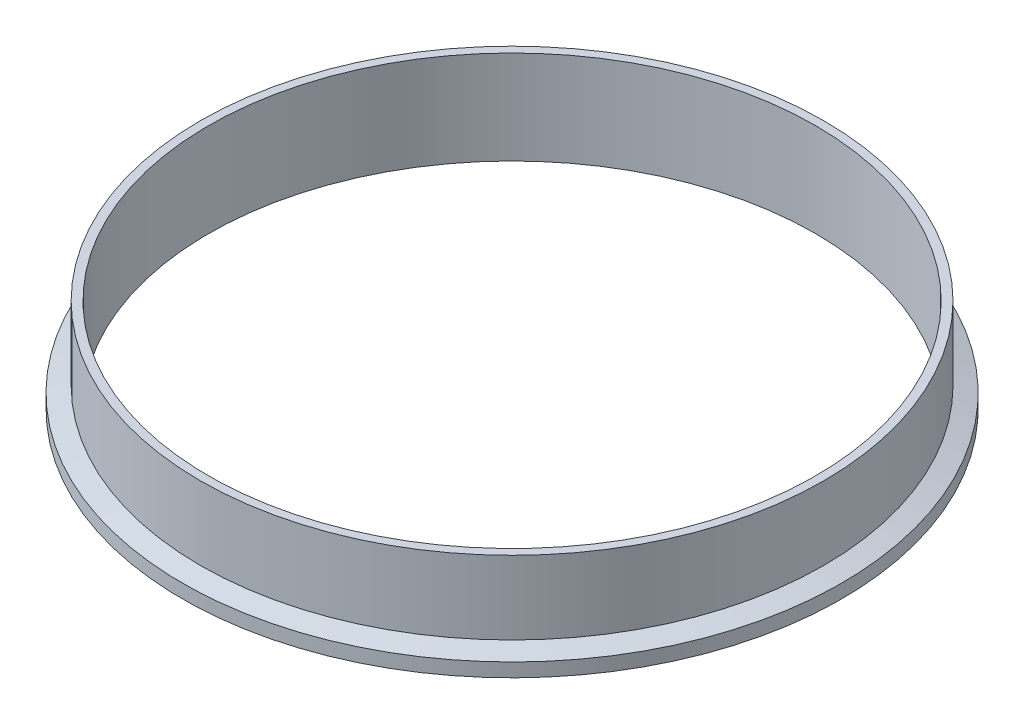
SolidWorks part; units mm, degrees
ref_plane "Front Plane" through (0, 0, 0) normal (0, 0, 1) x (1, 0, 0)
ref_plane "Top Plane" through (0, 0, 0) normal (0, 1, 0) x (1, 0, 0)
ref_plane "Right Plane" through (0, 0, 0) normal (1, 0, 0) x (0, 0, -1)
sketch "Sketch1" plane through (0, 0, 0) normal (0, 0, 1) x (1, 0, 0)
  line L0 (0, 0) -> (0, 38.1) construction
  line L1 (0, 38.1) -> (-127, 38.1)
  line L2 (-127, 38.1) -> (-127, 8.2228)
  line L3 (-127, 8.2228) -> (-134.239, 5.588)
  line L4 (-134.239, 5.588) -> (-134.239, 0)
  line L5 (-134.239, 0) -> (-130.7992, 0)
  line L6 (-127.1632, 0) -> (0, 0)
  line L7 (0, 0) -> (0, 38.1)
  line L8 (0, 38.1) -> (-123.5964, 38.1)
  line L9 (-123.5964, 38.1) -> (-123.5964, 0)
  line L10 (-123.5964, 0) -> (0, 0)
  line L11 (0, 0) -> (-0.1846, 0.0129)
  arc A0 (-130.0767, 0.4745) -> (-127.8857, 0.4745) centre (-128.9812, 0) cw
  arc A1 (-127.1632, 0) -> (-127.8857, 0.4745) centre (-127.1632, 0.7874) cw
  arc A2 (-130.0767, 0.4745) -> (-130.7992, 0) centre (-130.7992, 0.7874) cw
  point P12 (-127.7874, 0)
  dimension "D6" = 1.1938
  dimension "D7" = 0.7874
  dimension "3.00" = 127
  dimension "D2" = 5.588
  dimension "D3" = 134.239
  dimension "D4" = 70
  dimension "D5" = 128.9812
  dimension "D8" = 3.4036
  dimension "D9" = 38.1
revolve "Revolve2" add sketch "Sketch1" angle 360 about L0
